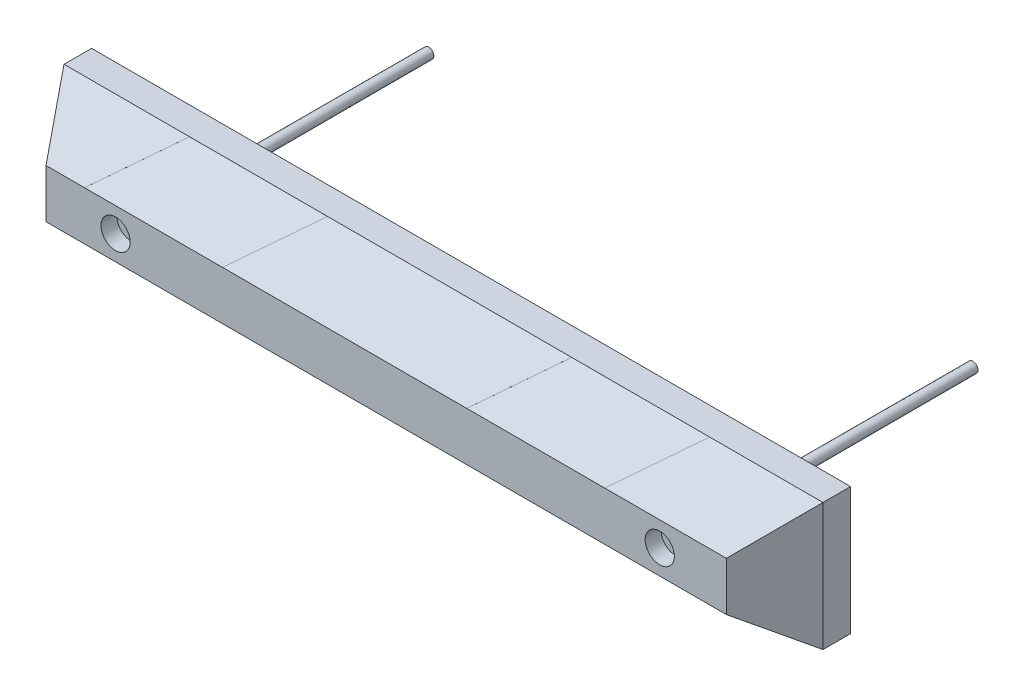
SolidWorks part; units mm, degrees
ref_plane "Front Plane" through (0, 0, 0) normal (0, 0, 1) x (1, 0, 0)
ref_plane "Top Plane" through (0, 0, 0) normal (0, 1, 0) x (1, 0, 0)
ref_plane "Right Plane" through (0, 0, 0) normal (1, 0, 0) x (0, 0, -1)
sketch "Sketch1" plane through (0, 0, 0) normal (0, 0, 1) x (1, 0, 0)
  line L0 (0, 76.2) -> (0, -76.2) construction
  line L1 (-454.025, 76.2) -> (454.025, 76.2)
  line L2 (-454.025, 76.2) -> (-454.025, -76.2)
  line L3 (-454.025, -76.2) -> (454.025, -76.2)
  line L4 (454.025, 76.2) -> (454.025, -76.2)
  dimension "D1" = 908.05
  dimension "D2" = 152.4
extrude "Boss-Extrude1" add sketch "Sketch1" along normal blind 33.02
sketch "Sketch2" plane through (0, 0, 33.02) normal (0, 0, 1) x (1, 0, 0)
  line L1 (-454.025, 76.2) -> (454.025, 76.2)
  line L2 (-454.025, 76.2) -> (-454.025, -76.2)
  line L3 (-454.025, -76.2) -> (454.025, -76.2)
  line L4 (454.025, 76.2) -> (454.025, -76.2)
extrude "Boss-Extrude2" add sketch "Sketch2" along normal blind 68.58 draft 34.45
sketch "Sketch3" plane through (0, 0, 101.6) normal (0, 0, 1) x (1, 0, 0)
  line L0 (-406.9793, 0) -> (406.9793, 0) construction
  line L1 (-406.9793, 29.1543) -> (-406.9793, -29.1543) construction
  line L2 (406.9793, -29.1543) -> (406.9793, 29.1543) construction
  line L4 (-454.025, 76.2) -> (-454.025, -76.2) construction
  circle A0 centre (-323.723, 0) radius 7.9375
  circle A1 centre (327.279, 0) radius 7.9375
  dimension "D1" = 130.302
  dimension "D2" = 651.002
  dimension "D5" = 15.875
extrude "Cut-Extrude1" cut sketch "Sketch3" against normal through all
sketch "Sketch4" plane through (0, 0, 101.6) normal (0, 0, 1) x (1, 0, 0)
  line L0 (-406.9793, 0) -> (867.3543, 0) construction
  line L1 (-406.9793, 29.1543) -> (-406.9793, -29.1543) construction
  line L2 (-454.025, 76.2) -> (-454.025, -76.2) construction
  circle A1 centre (-323.723, 0) radius 7.9375 construction
  circle A2 centre (327.279, 0) radius 7.9375 construction
  circle A5 centre (-323.723, 0) radius 17.4625
  circle A6 centre (327.279, 0) radius 17.4625
  dimension "D1" = 130.302
  dimension "D3" = 651.002
extrude "Cut-Extrude3" cut sketch "Sketch4" against normal blind 19.05
sketch "Sketch5" plane through (0, -67.2189, 46.112) normal (0, -0.8246, 0.5657) x (1, 0, 0)
  line L0 (-360.8714, 67.2892) -> (-195.7714, 67.2892)
  line L1 (-406.9793, 67.2892) -> (406.9793, 67.2892) construction
  line L2 (-195.7714, 67.2892) -> (-138.7201, -15.8764)
  line L3 (-454.025, -15.8764) -> (454.025, -15.8764) construction
  line L4 (-138.7201, -15.8764) -> (-303.8201, -15.8764)
  line L5 (-303.8201, -15.8764) -> (-360.8714, 67.2892)
  line L6 (-195.7714, 67.2892) -> (96.3286, 67.2892) construction
  line L7 (96.3286, 67.2892) -> (153.3799, -15.8764)
  line L8 (153.3799, -15.8764) -> (-138.7201, -15.8764) construction
  line L9 (96.3286, 67.2892) -> (261.4286, 67.2892)
  line L10 (261.4286, 67.2892) -> (318.4799, -15.8764)
  line L11 (318.4799, -15.8764) -> (153.3799, -15.8764)
  dimension "D1" = 165.1
  dimension "D2" = 292.1
  dimension "D3" = 165.1
  dimension "D4" = 124.45
extrude "Cut-Extrude4" cut sketch "Sketch5" against normal blind 0.0254
pattern_linear "LPattern1" [suppressed] count 3 spacing 383.54
mirror "Mirror1" about plane through (0, 0, 0) normal (0, 1, 0) of "LPattern1", "Cut-Extrude4"
sketch "Sketch6" plane through (0, 0, 0) normal (0, 0, -1) x (-1, 0, 0)
  circle A0 centre (323.723, 0) radius 16.7449
  circle A1 centre (-327.279, 0) radius 16.7449
extrude "Boss-Extrude3" add sketch "Sketch6" along normal blind 0.0254
sketch "Sketch7" plane through (0, 0, 0) normal (0, 0, 1) x (1, 0, 0)
  circle A2 centre (327.279, 0) radius 6.35
  circle A3 centre (-323.723, 0) radius 6.35
  circle A4 centre (-323.723, 0) radius 16.7449 construction
  circle A5 centre (327.279, 0) radius 16.7449 construction
  dimension "D1" = 12.7
extrude "Boss-Extrude4" add sketch "Sketch7" against normal blind 273.05 draft 0.05
